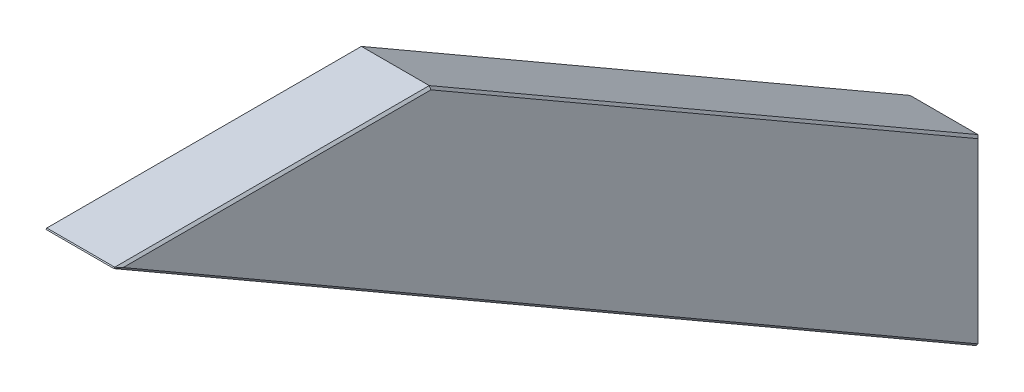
SolidWorks part; units mm, degrees
ref_plane "Спереди" through (0, 0, 0) normal (0, 0, 1) x (1, 0, 0)
ref_plane "Сверху" through (0, 0, 0) normal (0, 1, 0) x (1, 0, 0)
ref_plane "Справа" through (0, 0, 0) normal (1, 0, 0) x (0, 0, -1)
sketch "Эскиз1" plane through (0, 0, 0) normal (1, 0, 0) x (0, 0, -1)
  line L0 (0, 0) -> (-70, 0)
  line L1 (-70, 0) -> (121.24, -110.4125)
  line L2 (121.24, -110.4125) -> (121.24, -69.9979)
  line L3 (121.24, -69.9979) -> (0, 0)
  dimension "D1" = 121.24
  dimension "D2" = 90
  dimension "D3" = 35
  dimension "D4" = 30
extrude "Бобышка-Вытянуть1" add sketch "Эскиз1" along normal mid plane 16
chamfer "Фаска1" distance 0.5 angle 45 10 edges at (0, 0, 70) (0, -110.4125, -121.24) (-8, 0, 35) (-8, -55.2062, -25.62) (-8, -90.2052, -121.24) (-8, -34.999, -60.62) (8, -90.2052, -121.24) (8, -55.2062, -25.62) (8, 0, 35) (8, -34.999, -60.62)
